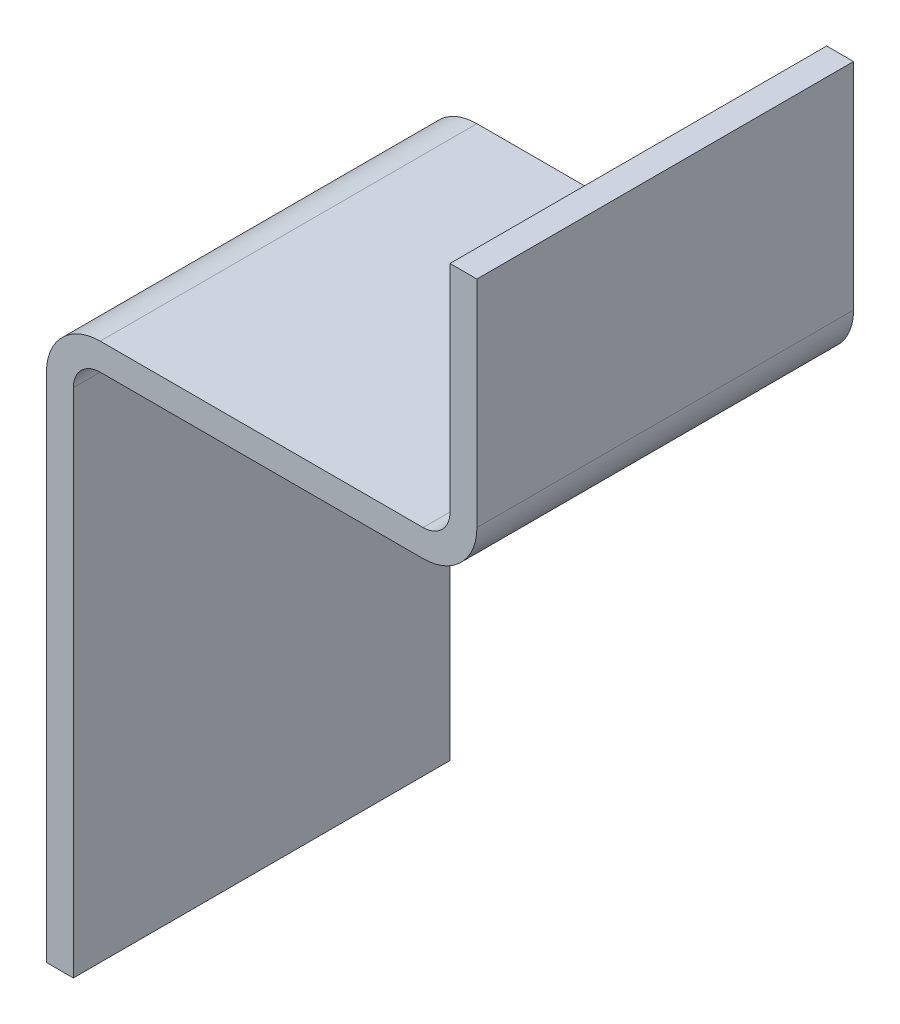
SolidWorks part; units mm, degrees
ref_plane "Vorne" through (0, 0, 0) normal (0, 0, 1) x (1, 0, 0)
ref_plane "Oben" through (0, 0, 0) normal (0, 1, 0) x (1, 0, 0)
ref_plane "Links" through (0, 0, 0) normal (1, 0, 0) x (0, 0, -1)
sketch "Skizze1" plane through (0, 0, 0) normal (0, 0, 1) x (1, 0, 0)
  line L0 (75, 110) -> (75, 150)
  line L1 (-5, 0) -> (-5, 95)
  line L2 (0, 0) -> (0, 95)
  line L3 (5, 100) -> (65, 100)
  line L4 (5, 105) -> (65, 105)
  line L5 (70, 110) -> (70, 150)
  line L6 (-5, 0) -> (0, 0)
  line L7 (0, 0) -> (-0.6152, 0.473)
  line L8 (70, 150) -> (75, 150)
  line L10 (0, 0) -> (0, 100) construction
  line L11 (0, 100) -> (75, 100) construction
  line L12 (70, 105) -> (70, 150) construction
  line L13 (-5, 105) -> (70, 105) construction
  line L14 (-5, 0) -> (-5, 105) construction
  line L15 (75, 100) -> (75, 150) construction
  arc A0 (0, 95) -> (5, 100) centre (5, 95) cw
  arc A1 (70, 110) -> (65, 105) centre (65, 110) cw
  arc A2 (5, 105) -> (-5, 95) centre (5, 95) ccw
  arc A3 (75, 110) -> (65, 100) centre (65, 110) cw
  dimension "D5" = 5
  dimension "D6" = 10
  dimension "D1" = 100
  dimension "D2" = 75
  dimension "D3" = 50
  dimension "D4" = 5
extrude "Linear austragen1" add sketch "Skizze1" along normal blind 70
